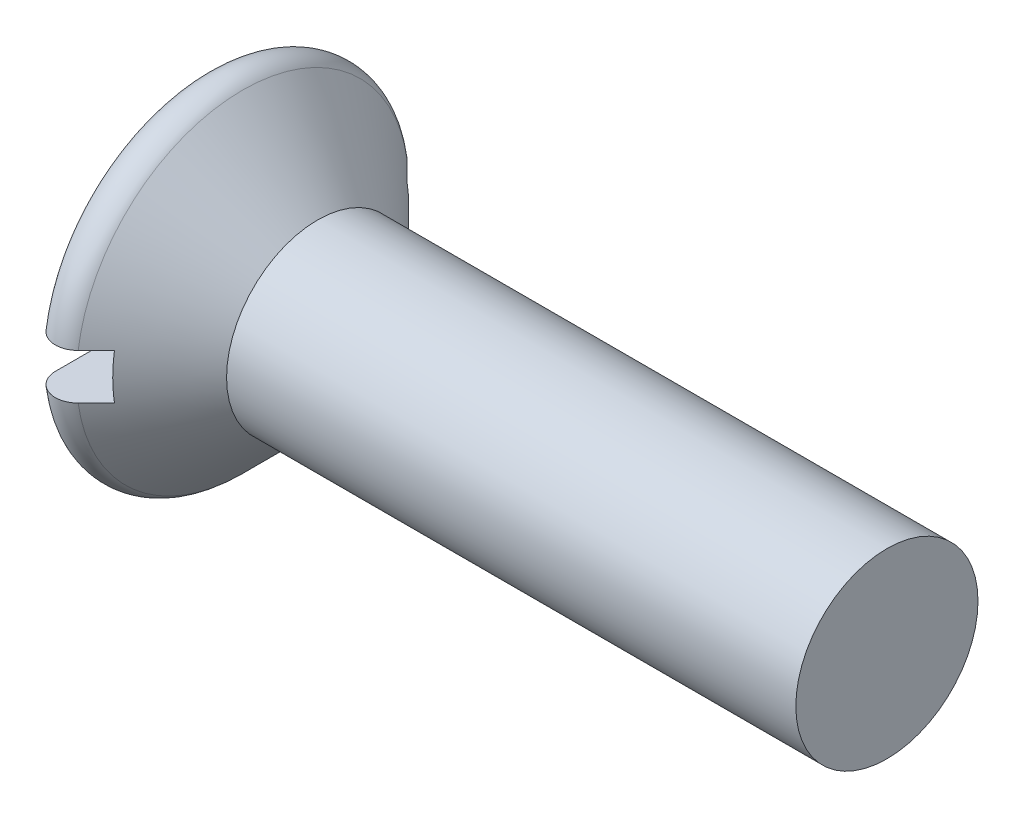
SolidWorks part; units mm, degrees
ref_plane "Front" through (0, 0, 0) normal (0, 0, 1) x (1, 0, 0)
ref_plane "Top" through (0, 0, 0) normal (0, 1, 0) x (1, 0, 0)
ref_plane "Right" through (0, 0, 0) normal (1, 0, 0) x (0, 0, -1)
sketch "Sketch1" plane through (0, 0, 0) normal (0, 0, 1) x (1, 0, 0)
  line L0 (0, 0) -> (0, 1.8)
  line L1 (0, 1.8) -> (1, 0.8)
  line L3 (6, 0.8) -> (6, 0)
  line L4 (6, 0) -> (0, 0)
  line L5 (-5.5696, 0) -> (0, 0) construction
  line L6 (1, 0.8) -> (6, 0.8)
  dimension "l" = 6
  dimension "dk" = 3.6
  dimension "k" = 1
  dimension "d" = 1.6
revolve "Base" add sketch "Sketch1" angle 360 about L5
fillet "HeadFillet" radius 0.2 1 edges at (0, 0, 1.8)
sketch "Sketch2" plane through (0, 0, 0) normal (0, 0, 1) x (1, 0, 0)
  line L1 (0, 0.2) -> (0.5, 0.2)
  line L2 (0, 0.2) -> (0, -0.2)
  line L3 (0, -0.2) -> (0.5, -0.2)
  line L4 (0.5, 0.2) -> (0.5, -0.2)
  dimension "t" = 0.5
  dimension "n" = 0.4
  dimension "m" = 0.2
extrude "Notch" cut sketch "Sketch2" against normal through all and the other way through all
sketch "Sketch3" plane through (0, 0, 0) normal (0, 0, 1) x (1, 0, 0)
  line L0 (4.4877, 0) -> (-0.464, 0) construction
  line L1 (1, 9.19) -> (-19, 9.19)
  line L2 (1, 9.19) -> (1, 4.19)
  line L3 (1, 4.19) -> (-19.9, 4.19)
  line L4 (-19, 9.19) -> (-19, 0.8)
  line L6 (-19, 0.8) -> (-19.9, 4.19)
  line L7 (6, -0.8) -> (6, 0.8) construction
  line L10 (0, 1.3172) -> (0, 0.2) construction
  dimension "d1" = 8.38
  dimension "b" = 25
  dimension "x" = 0.9
  dimension "D4" = 5
sketch "Sketch4" plane through (0, 0, 0) normal (0, 0, 1) x (1, 0, 0)
  line L0 (6, 0.6359) -> (6.0947, 0.8)
  line L1 (6.0947, 0.8) -> (6.0947, 0.9895)
  line L2 (6.0947, 0.9895) -> (5.9053, 0.9895)
  line L3 (5.9053, 0.9895) -> (5.9053, 0.8)
  line L4 (5.9053, 0.8) -> (6, 0.6359)
  line L5 (6, -0.8) -> (6, 0.8) construction
  line L6 (0, 0) -> (84.1591, 0) construction
  dimension "D1" = 1.6
  dimension "D2" = 0.1895
revolve "Cut-Revolve10" [suppressed] cut sketch "Sketch4" angle 360 about L6
pattern_linear "LPattern10" [suppressed] count 22 spacing 0.2274 along (1, 0, 0)
equation "\"m@Sketch2\" = \"n@Sketch2\" / 2"
equation "\"D1@Sketch4\" = \"d@Sketch1\""
equation "\"D2@Sketch4\" =  ( \"d@Sketch1\" - \"D2@ThreadCosmetic1\" )  / 2"
equation "\"D3@LPattern10\" = \"D2@Sketch4\" * 1.2"
equation "\"D1@LPattern10\" = \"D1@ThreadCosmetic1\" / \"D3@LPattern10\""
